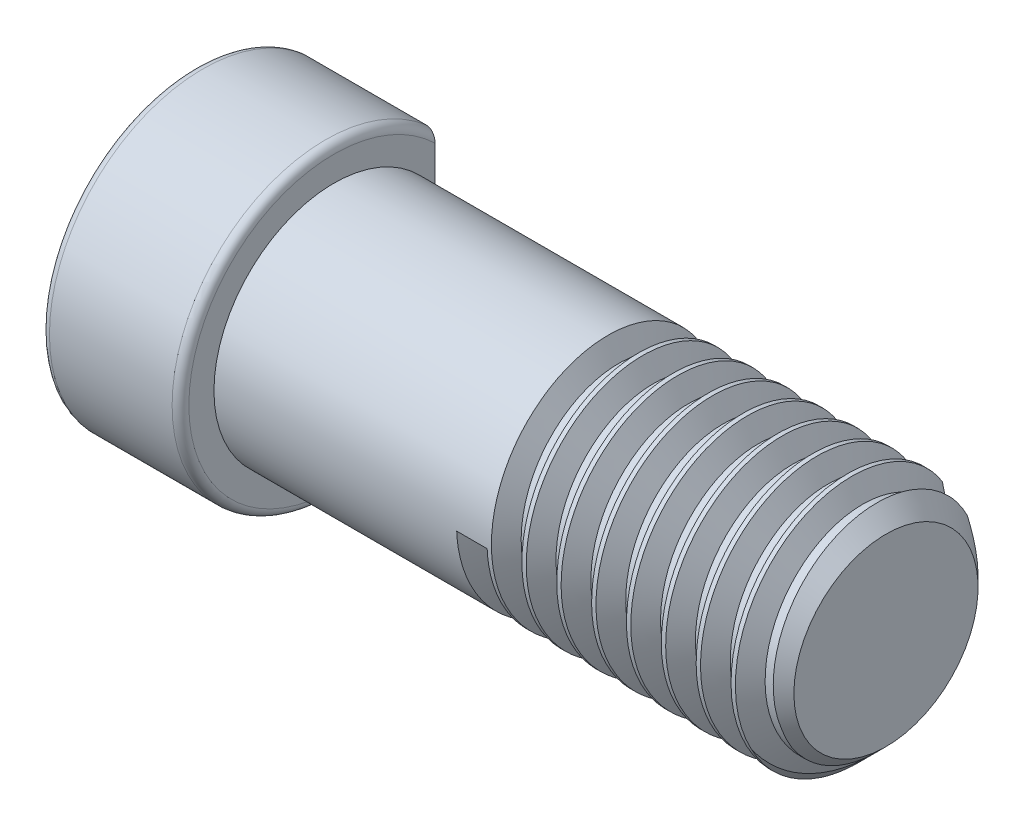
SolidWorks part; units mm, degrees
ref_plane "Front Plane" through (0, 0, 0) normal (0, 0, 1) x (1, 0, 0)
ref_plane "Top Plane" through (0, 0, 0) normal (0, 1, 0) x (1, 0, 0)
ref_plane "Right Plane" through (0, 0, 0) normal (1, 0, 0) x (0, 0, -1)
sketch "Sketch1" plane through (0, 0, 0) normal (0, 1, 0) x (1, 0, 0)
  line L0 (0, 0) -> (31.496, 0)
  line L1 (31.496, 0) -> (31.496, -5.465)
  line L2 (31.496, -5.465) -> (6.35, -5.465)
  line L3 (6.35, -5.465) -> (6.35, -6.989)
  line L4 (6.35, -6.989) -> (0, -6.989)
  line L5 (0, -6.989) -> (0, 0)
  dimension "D1" = 6.989
  dimension "D2" = 6.35
  dimension "D3" = 31.496
  dimension "D4" = 5.465
revolve "Revolve1" add sketch "Sketch1" angle 360 about L0
thread "Thread1" pitch 1.5875 start angle 0, offset 1.5875, length 0, pitch 1.5875, diameter 10.93
ref_plane "Plane1" through (33.0835, 0, 5.465) normal (0, -1, 0) x (0, 0, 1)
sketch "Thread Profile1" plane through (33.0835, 0, 5.465) normal (0, -1, 0) x (0, 0, 1)
  line L0 (0, 0) -> (0, 1.5875) construction
  line L11 (0, 0) -> (0, 1.3891)
  line L12 (0, 1.3891) -> (-0.8593, 0.893)
  line L13 (-0.8593, 0.893) -> (-0.8593, 0.4961)
  line L15 (-0.8593, 0.4961) -> (0, 0)
  line L17 (-0.8593, 0.6945) -> (0, 0.6945) construction
  point P2 (0, 0)
  dimension "Pitch" = 1.5875
  dimension "Profile_Angle" = 60
  dimension "Profile_Land" = 0.3969
  dimension "Profile_Height" = 0.8593
sketch "Sketch5" plane through (0, 0, 0) normal (-1, 0, 0) x (0, 0, 1)
  line L0 (-5.465, 0) -> (-4.6065, 0) construction
  line L1 (-4.6065, 5.2561) -> (-4.6065, -5.2561)
  circle A0 centre (0, 0) radius 5.465 construction
  circle A1 centre (0, 0) radius 5.465 construction
  circle A3 centre (0, 0) radius 6.989 construction
  arc A4 (-4.6065, 5.2561) -> (-4.6065, -5.2561) centre (0, 0) ccw
  point P9 (-4.6065, 0)
  dimension "D1" = 0.8585
extrude "Cut-Extrude1" cut sketch "Sketch5" against normal through all both and the other way through all
sketch "Sketch6" plane through (0, 0, 0) normal (-1, 0, 0) x (0, 0, 1)
  line L1 (3.6175, -2.0886) -> (3.6175, 2.0886)
  line L2 (3.6175, 2.0886) -> (0, 4.1771)
  line L3 (0, 4.1771) -> (-3.6175, 2.0886)
  line L4 (-3.6175, 2.0886) -> (-3.6175, -2.0886)
  line L5 (-3.6175, -2.0886) -> (0, -4.1771)
  line L6 (0, -4.1771) -> (3.6175, -2.0886)
  circle A0 centre (0, 0) radius 3.6175 construction
  dimension "D1" = 7.235
extrude "Cut-Extrude2" cut sketch "Sketch6" against normal blind 10.795
sketch "Sketch7" plane through (0, 0, 3.6175) normal (0, 0, -1) x (-1, 0, 0)
  line L0 (-10.795, 2.0886) -> (0, 2.0886) construction
  line L1 (-10.795, -2.0886) -> (-9.4456, -2.0886)
  line L2 (-10.795, -2.0886) -> (-10.795, 2.0886)
  line L3 (-10.795, 2.0886) -> (-9.4456, 2.0886)
  line L4 (-9.4456, -2.0886) -> (-9.4456, 2.0886)
  line L5 (-10.795, -2.0886) -> (0, -2.0886) construction
  line L6 (-8.0962, -2.0886) -> (-6.7469, -2.0886)
  line L7 (-8.0962, -2.0886) -> (-8.0962, 2.0886)
  line L8 (-8.0962, 2.0886) -> (-6.7469, 2.0886)
  line L9 (-6.7469, -2.0886) -> (-6.7469, 2.0886)
  line L10 (-9.4456, 0) -> (-8.0962, 0) construction
  line L11 (-5.3975, -2.0886) -> (-4.0481, -2.0886)
  line L12 (-5.3975, -2.0886) -> (-5.3975, 2.0886)
  line L13 (-5.3975, 2.0886) -> (-4.0481, 2.0886)
  line L14 (-4.0481, -2.0886) -> (-4.0481, 2.0886)
  line L15 (-2.6987, -2.0886) -> (-1.3494, -2.0886)
  line L16 (-2.6987, -2.0886) -> (-2.6987, 2.0886)
  line L17 (-2.6987, 2.0886) -> (-1.3494, 2.0886)
  line L18 (-1.3494, -2.0886) -> (-1.3494, 2.0886)
  line L19 (-8.0962, 0) -> (-6.7469, 0) construction
  line L20 (-6.7469, 0) -> (-5.3975, 0) construction
  line L21 (-5.3975, 0) -> (-4.0481, 0) construction
  line L22 (-4.0481, 0) -> (-2.6987, 0) construction
  line L23 (-2.6987, 0) -> (-1.3494, 0) construction
  line L24 (-1.3494, 0) -> (0, 0) construction
  line L25 (-9.4456, 0) -> (-10.795, 0) construction
extrude "Cut-Extrude3" cut sketch "Sketch7" against normal blind 0.2
sketch "Sketch8" plane through (0, 0, 0) normal (0, 1, 0) x (1, 0, 0)
  line L0 (31.496, 4.6057) -> (31.496, -4.195) construction
  line L1 (31.496, -5.465) -> (31.496, 1.7625) construction
  line L2 (31.496, -4.195) -> (30.226, -5.465)
  line L3 (30.226, -5.465) -> (31.496, -5.465)
  line L4 (31.496, -5.465) -> (31.496, -4.195)
  line L5 (0, 0) -> (31.496, 0) construction
  dimension "D1" = 1.27
revolve "Cut-Revolve1" cut sketch "Sketch8" angle 360 about L5
fillet "Fillet1" radius 0.381 2 edges at (0, 0, 6.989) (6.35, 0, 6.989)
